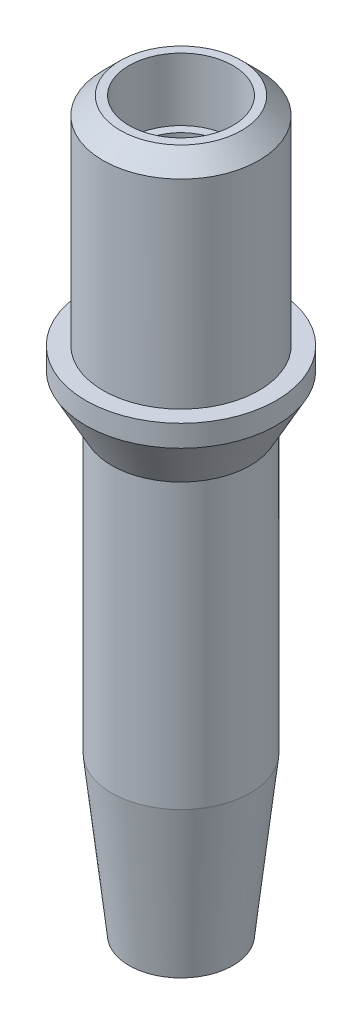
SolidWorks part; units mm, degrees
ref_plane "Face" through (0, 0, 0) normal (0, 0, 1) x (1, 0, 0)
ref_plane "Dessus" through (0, 0, 0) normal (0, 1, 0) x (1, 0, 0)
ref_plane "Droite" through (0, 0, 0) normal (1, 0, 0) x (0, 0, -1)
sketch "Esquisse1" plane through (0, 0, 0) normal (0, 0, 1) x (1, 0, 0)
  line L0 (0, 0) -> (0, 97.0465) construction
  line L1 (20, 6) -> (18, -20.6219)
  line L3 (24, 100) -> (36, 100)
  line L4 (36, 100) -> (36, 0)
  line L5 (36, 0) -> (44, 0)
  line L6 (44, 0) -> (44, -10)
  line L7 (44, -10) -> (32, -32)
  line L8 (32, -32) -> (32, -163)
  line L9 (32, -163) -> (24, -236)
  line L10 (24, -236) -> (13, -236)
  line L11 (13, -236) -> (13, -206)
  line L12 (13, -206) -> (20, -206)
  line L13 (20, -206) -> (20, -26)
  line L14 (20, -26) -> (18, -26)
  line L15 (18, -26) -> (18, -20.6219)
  line L18 (20, 6) -> (20, 71)
  line L19 (24, 71) -> (24, 100)
  line L20 (20, 71) -> (24, 71)
  dimension "D1" = 36
  dimension "D2" = 24
  dimension "D3" = 100
  dimension "D4" = 20
  dimension "D5" = 10
  dimension "D6" = 32
  dimension "D7" = 22
  dimension "D8" = 12
  dimension "D9" = 29
  dimension "D10" = 236
  dimension "D11" = 131
  dimension "D12" = 24
  dimension "D13" = 13
  dimension "D14" = 30
  dimension "D15" = 180
  dimension "D16" = 20
  dimension "D17" = 18
  dimension "D18" = 65
revolve "Révolution1" add sketch "Esquisse1" angle 360 about L0
chamfer "Chanfrein4" distance 6 angle 45
fillet "Congé1" radius 4
chamfer "Chanfrein5" distance 8 angle 45
